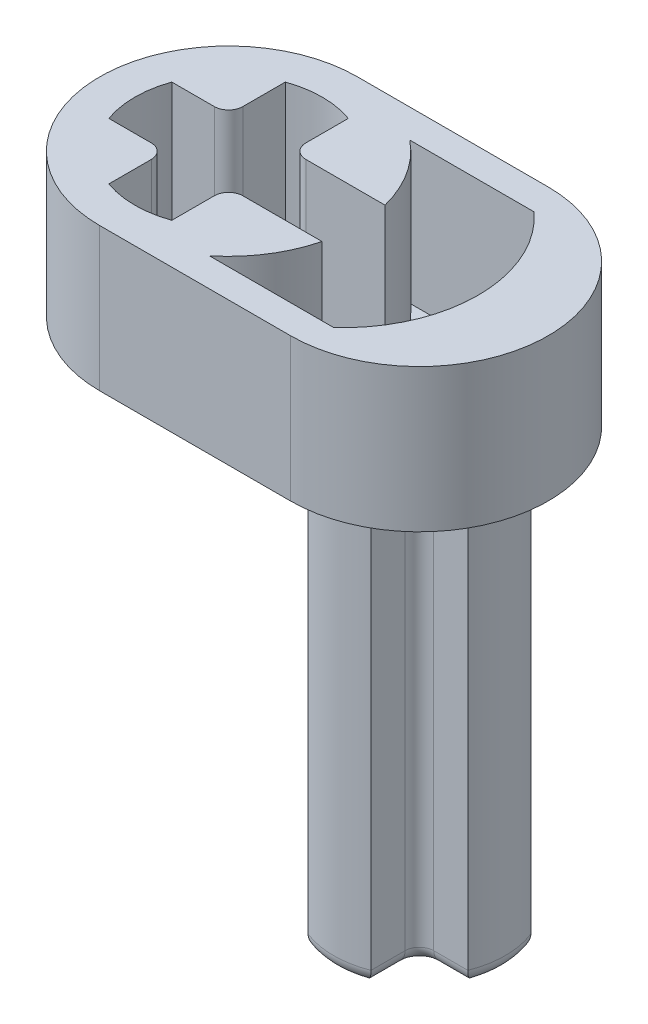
SolidWorks part; units mm, degrees
ref_plane "정면" through (0, 0, 0) normal (0, 0, 1) x (1, 0, 0)
ref_plane "윗면" through (0, 0, 0) normal (0, 1, 0) x (1, 0, 0)
ref_plane "우측면" through (0, 0, 0) normal (1, 0, 0) x (0, 0, -1)
imported_body "파트6-1-solid1"
imported_body "파트5-1-solid1"
sketch "스케치1" plane through (0, 0.7048, 0) normal (0, 1, 0) x (1, 0, 0)
  line L0 (-2.2963, -11.653) -> (-4.5071, -11.653) construction
  line L1 (-3.7335, -11.653) -> (-2.2963, -11.653)
  line L2 (-3.7335, -11.653) -> (-3.7335, -13.413)
  line L3 (-3.7335, -13.413) -> (-2.2963, -13.413)
  line L5 (-2.2963, -13.413) -> (-4.5071, -13.413) construction
  line L6 (-3.5244, -9.733) -> (-0.0499, -9.733)
  line L7 (-3.5244, -15.333) -> (-0.0499, -15.333)
  arc A0 (-3.5244, -15.333) -> (-2.2963, -13.413) centre (-5.7871, -12.533) ccw
  arc A1 (-0.0499, -15.333) -> (-0.0499, -9.733) centre (-2.5995, -12.533) ccw
  arc A2 (-2.2963, -11.653) -> (-3.5244, -9.733) centre (-5.7871, -12.533) ccw
extrude "컷-돌출1" cut sketch "스케치1" against normal up to surface (3.95 mm away)
